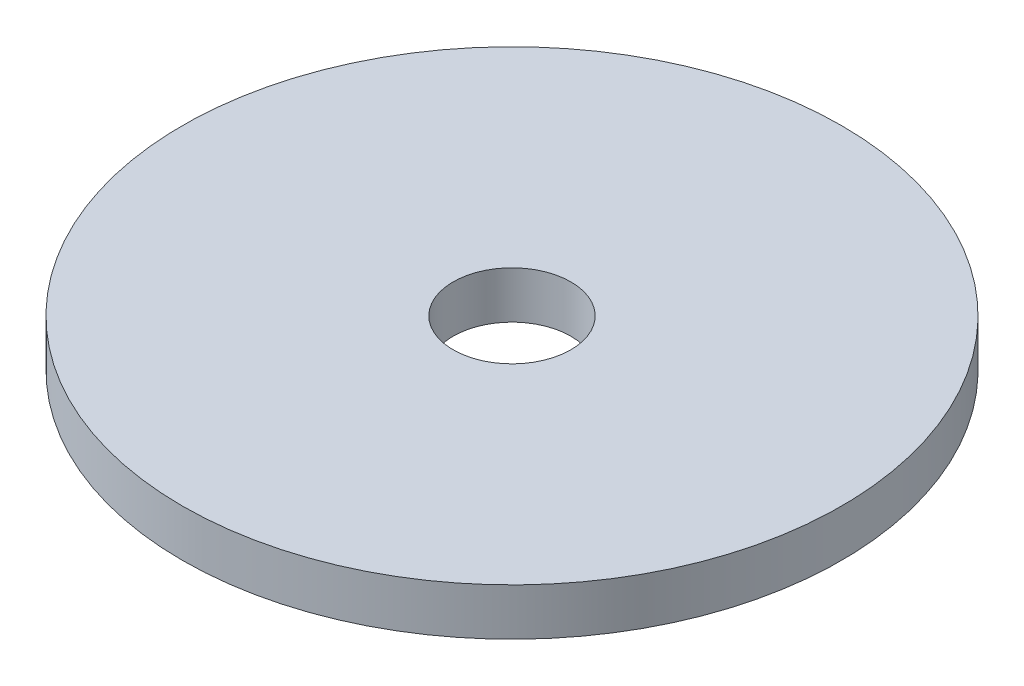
SolidWorks part; units mm, degrees
ref_plane "Front Plane" through (0, 0, 0) normal (0, 0, 1) x (1, 0, 0)
ref_plane "Top Plane" through (0, 0, 0) normal (0, 1, 0) x (1, 0, 0)
ref_plane "Right Plane" through (0, 0, 0) normal (1, 0, 0) x (0, 0, -1)
sketch "Sketch1" plane through (0, 0, 0) normal (0, 0, 1) x (1, 0, 0)
  line L0 (0, 0) -> (0, 58.3608) construction
  line L2 (2.5, 0) -> (14, 0)
  line L3 (2.5, 0) -> (2.5, 2)
  line L4 (2.5, 2) -> (14, 2)
  line L5 (14, 0) -> (14, 2)
  dimension "D1" = 2
  dimension "D2" = 28
  dimension "D3" = 5
revolve "Revolve1" add sketch "Sketch1" angle 360 about L0
